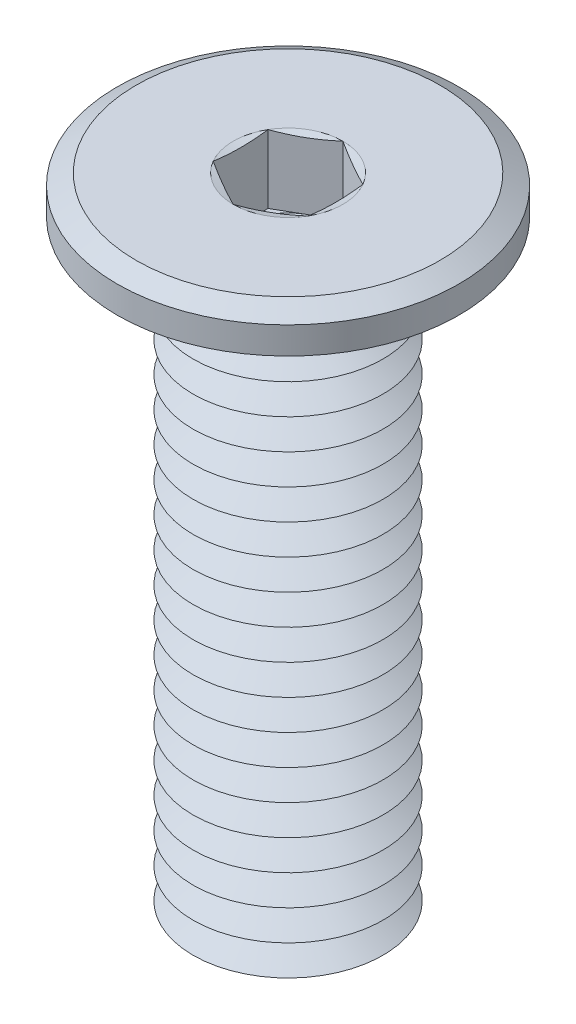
SolidWorks part; units mm, degrees
ref_plane "Front Plane" through (0, 0, 0) normal (0, 0, 1) x (1, 0, 0)
ref_plane "Top Plane" through (0, 0, 0) normal (0, 1, 0) x (1, 0, 0)
ref_plane "Right Plane" through (0, 0, 0) normal (1, 0, 0) x (0, 0, -1)
sketch "Sketch1" plane through (0, 0, 0) normal (0, 1, 0) x (1, 0, 0)
  circle A0 centre (0, 0) radius 4.5
  dimension "D1" = 9
extrude "Boss-Extrude1" add sketch "Sketch1" against normal blind 1
sketch "Sketch2" plane through (0, -1, 0) normal (0, -1, 0) x (1, 0, 0)
  circle A0 centre (0, 0) radius 2.5
  dimension "D1" = 5
extrude "Boss-Extrude2" add sketch "Sketch2" along normal blind 16
sketch "Sketch3" plane through (0, 0, 0) normal (1, 0, 0) x (0, 0, -1)
  line L0 (0, 0.9906) -> (0, -8.2999) construction
sketch "Sketch5" plane through (0, 0, 0) normal (1, 0, 0) x (0, 0, -1)
  line L0 (-2.5, -17.4) -> (-1.8072, -17)
  line L1 (-2.5, -1) -> (-2.5, -17) construction
  line L2 (-1.8072, -17) -> (-2.5, -16.6)
  line L3 (-2.5, -1) -> (-2.5, -17) construction
  line L4 (-2.5, -16.6) -> (-2.5, -17.4)
  line L6 (-2.5, -1) -> (-2.5, -17) construction
  line L7 (-2.5, -1) -> (-2.5, -17) construction
  line L14 (-2.5, -17) -> (2.5, -17) construction
  dimension "D1" = 0.8
revolve "Cut-Revolve1" cut sketch "Sketch5" angle 360 about L0
pattern_linear "LPattern1" count 19 spacing 0.8 along (0, 1, 0) of "Cut-Revolve1"
fillet "Fillet1" radius 0.2 1 edges at (0, -1, -2.5)
chamfer "Chamfer2" distance 0.5 angle 30 1 edges at (0, 0, 4.5)
sketch "Sketch6" plane through (0, 0, 0) normal (0, 1, 0) x (1, 0, 0)
  line L1 (0, 1.4434) -> (-1.25, 0.7217)
  line L2 (-1.25, 0.7217) -> (-1.25, -0.7217)
  line L3 (-1.25, -0.7217) -> (0, -1.4434)
  line L4 (0, -1.4434) -> (1.25, -0.7217)
  line L5 (1.25, -0.7217) -> (1.25, 0.7217)
  line L6 (1.25, 0.7217) -> (0, 1.4434)
  circle A0 centre (0, 0) radius 1.25 construction
  dimension "D1" = 2.5
extrude "Cut-Extrude1" cut sketch "Sketch6" against normal blind 1.8
sketch "Sketch7" plane through (0, -1.8, 0) normal (0, 1, 0) x (1, 0, 0)
  line L0 (-1.25, 0.7217) -> (-1.25, -0.7217) construction
  circle A0 centre (0, 0) radius 1.25
extrude "Cut-Extrude2" cut sketch "Sketch7" against normal through all draft 60
sketch "Sketch8" plane through (0, 0, 0) normal (0, 1, 0) x (1, 0, 0)
  circle A0 centre (0, 0) radius 1.4434
extrude "Cut-Extrude3" cut sketch "Sketch8" against normal through all draft 75
